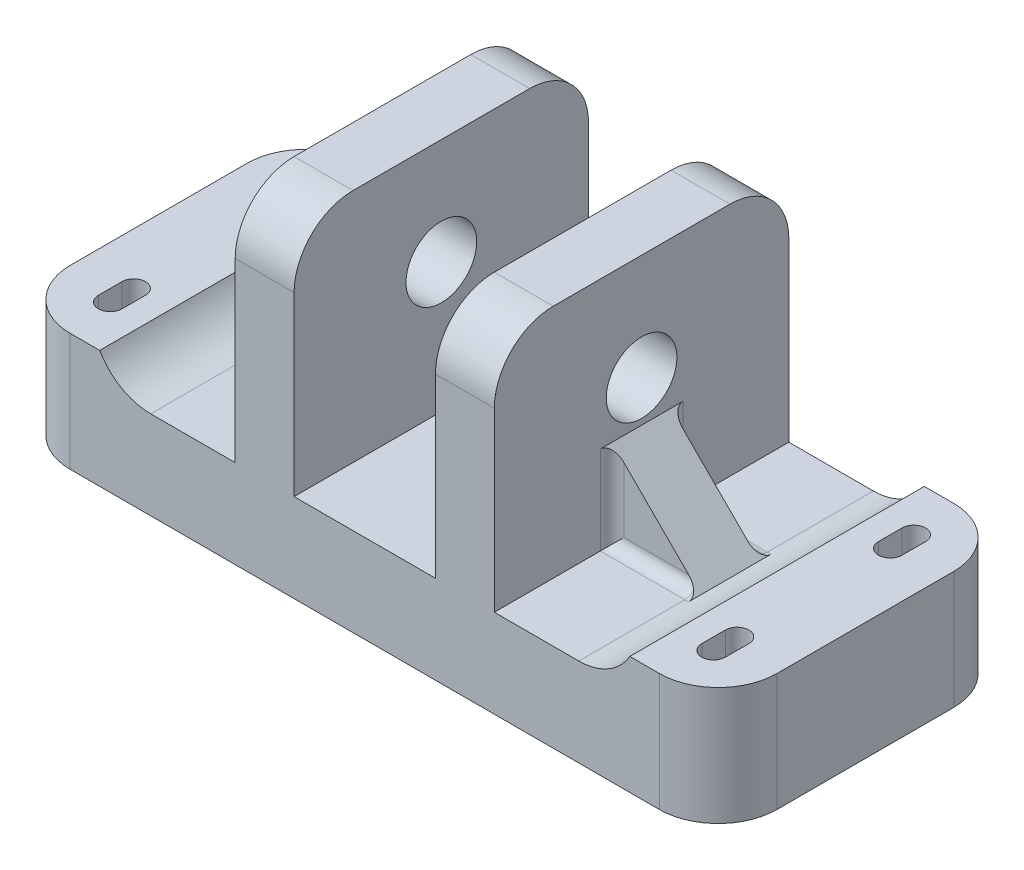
SolidWorks part; units mm, degrees
ref_plane "Front Plane" through (0, 0, 0) normal (0, 0, 1) x (1, 0, 0)
ref_plane "Top Plane" through (0, 0, 0) normal (0, 1, 0) x (1, 0, 0)
ref_plane "Right Plane" through (0, 0, 0) normal (1, 0, 0) x (0, 0, -1)
sketch "Szkic3" plane through (0, 0, 0) normal (0, 0, 1) x (1, 0, 0)
  line L1 (60, 0) -> (-60, 0)
  line L2 (60, 0) -> (60, 20)
  line L3 (60, 20) -> (-60, 20)
  line L4 (-60, 0) -> (-60, 20)
  point P4 (0, 0)
  dimension "D1" = 20
  dimension "D2" = 120
extrude "Dodanie-wyciągnięcie1" add sketch "Szkic3" along normal mid plane 50 contours L3 L4 L1 L2
fillet "Zaokrąglenie1" radius 10 4 edges at (-60, 10, -25) (-60, 10, 25) (60, 10, -25) (60, 10, 25)
sketch "Szkic4" plane through (0, 20, 0) normal (0, 1, 0) x (1, 0, 0)
  line L0 (60, 0) -> (45, 0)
  line L1 (60, -15) -> (60, 15) construction
  line L2 (0, 0) -> (0, 33.0157) construction
  line L5 (45, -25) -> (45, 25)
  line L9 (50, -25) -> (-50, -25) construction
  line L14 (-45, -25) -> (-45, 25)
  line L15 (45, 25) -> (-45, 25)
  line L16 (45, -25) -> (-45, -25)
  point P8 (0, 0)
  point P10 (0, 0)
  point P13 (0, 0)
  dimension "D1" = 15
  dimension "D2" = 50
  dimension "D3" = 45
  dimension "D4" = 25
extrude "Wytnij-wyciągnięcie1" cut sketch "Szkic4" against normal blind 5 contours L15 L14 L16 L5
fillet "Zaokrąglenie2" radius 10 2 edges at (-45, 15, 0) (45, 15, 0)
sketch "Szkic5" plane through (0, 15, 0) normal (0, 1, 0) x (1, 0, 0)
  line L1 (12, 25) -> (22, 25)
  line L2 (12, 25) -> (12, -25)
  line L3 (12, -25) -> (22, -25)
  line L4 (22, 25) -> (22, -25)
  line L6 (36.3397, 25) -> (-36.3397, 25) construction
  line L7 (36.3397, -25) -> (-36.3397, -25) construction
  line L8 (0, -0.8688) -> (0, 38.2288) construction
  line L9 (-12, -25) -> (-22, -25)
  line L10 (-22, 25) -> (-22, -25)
  line L11 (-12, 25) -> (-22, 25)
  line L12 (-12, 25) -> (-12, -25)
  dimension "D1" = 50
  dimension "D2" = 10
  dimension "D3" = 12
extrude "Dodanie-wyciągnięcie2" add sketch "Szkic5" along normal blind 40
fillet "Zaokrąglenie3" radius 10 4 edges at (-17, 55, -25) (-17, 55, 25) (17, 55, -25) (17, 55, 25)
sketch "Szkic6" plane through (-22, 0, 0) normal (-1, 0, 0) x (0, 0, 1)
  circle A0 centre (0, 37) radius 6
  dimension "D1" = 12
  dimension "D2" = 37
extrude "Wytnij-wyciągnięcie2" cut sketch "Szkic6" against normal blind 74
sketch "Szkic7" plane through (0, 20, 0) normal (0, 1, 0) x (1, 0, 0)
  line L0 (0, 0) -> (0, 32.4494) construction
  line L1 (0, 0) -> (18.8022, 0) construction
  line L2 (51.2182, 17) -> (51.2182, 13) construction
  line L3 (51.2182, -17) -> (51.2182, -13) construction
  line L4 (53.2182, 17) -> (53.2182, 13)
  line L5 (49.2182, 17) -> (49.2182, 13)
  line L6 (53.2182, -17) -> (53.2182, -13)
  line L7 (49.2182, -17) -> (49.2182, -13)
  line L8 (-51.2182, 17) -> (-51.2182, 13) construction
  line L9 (-53.2182, 17) -> (-53.2182, 13)
  line L10 (-49.2182, 17) -> (-49.2182, 13)
  line L11 (-51.2182, -17) -> (-51.2182, -13) construction
  line L12 (-53.2182, -17) -> (-53.2182, -13)
  line L13 (-49.2182, -17) -> (-49.2182, -13)
  arc A0 (53.2182, 17) -> (49.2182, 17) centre (51.2182, 17) ccw
  arc A1 (49.2182, 13) -> (53.2182, 13) centre (51.2182, 13) ccw
  arc A2 (53.2182, -17) -> (49.2182, -17) centre (51.2182, -17) cw
  arc A3 (49.2182, -13) -> (53.2182, -13) centre (51.2182, -13) cw
  arc A4 (-53.2182, 17) -> (-49.2182, 17) centre (-51.2182, 17) cw
  arc A5 (-49.2182, 13) -> (-53.2182, 13) centre (-51.2182, 13) cw
  arc A6 (-53.2182, -17) -> (-49.2182, -17) centre (-51.2182, -17) ccw
  arc A7 (-49.2182, -13) -> (-53.2182, -13) centre (-51.2182, -13) ccw
  point P6 (0, 0)
  point P7 (0, 0)
  point P8 (51.2182, 15)
  point P13 (0, 0)
  point P14 (51.2182, 12.0577)
  point P17 (51.2182, -15)
  point P24 (-51.2182, 15)
  point P31 (-51.2182, -15)
  dimension "D1" = 2
  dimension "D2" = 4
  dimension "D3" = 15
extrude "Wytnij-wyciągnięcie3" cut sketch "Szkic7" against normal blind 74
sketch "Szkic8" plane through (0, 0, 0) normal (0, 0, 1) x (1, 0, 0)
  line L0 (22, 15) -> (22, 30)
  line L1 (22, 45) -> (22, 15) construction
  line L2 (22, 15) -> (37, 15)
  line L3 (37, 15) -> (22, 30)
  line L4 (0, 0) -> (0, 33.3629) construction
  line L5 (50, 0) -> (-50, 0) construction
  line L6 (-22, 15) -> (-37, 15)
  line L7 (-22, 15) -> (-22, 30)
  line L8 (-37, 15) -> (-22, 30)
  point P13 (0, 0)
  point P14 (0, 0)
  dimension "D1" = 15
  dimension "D2" = 15
extrude "Dodanie-wyciągnięcie5" add sketch "Szkic8" along normal mid plane 10
fillet "Zaokrąglenie5" radius 2 3 edges at (36.6598, 15.0051, 5) (29.1699, 15, 5) (22, 22.5, 5)
fillet "Zaokrąglenie6" radius 2 3 edges at (-36.6598, 15.0051, 5) (-22, 22.5, 5) (-29.1699, 15, 5)
fillet "Zaokrąglenie7" radius 2 6 edges at (36.6598, 15.0051, -5) (-36.6598, 15.0051, -5) (22, 22.5, -5) (29.1699, 15, -5) (-22, 22.5, -5) (-29.1699, 15, -5)
